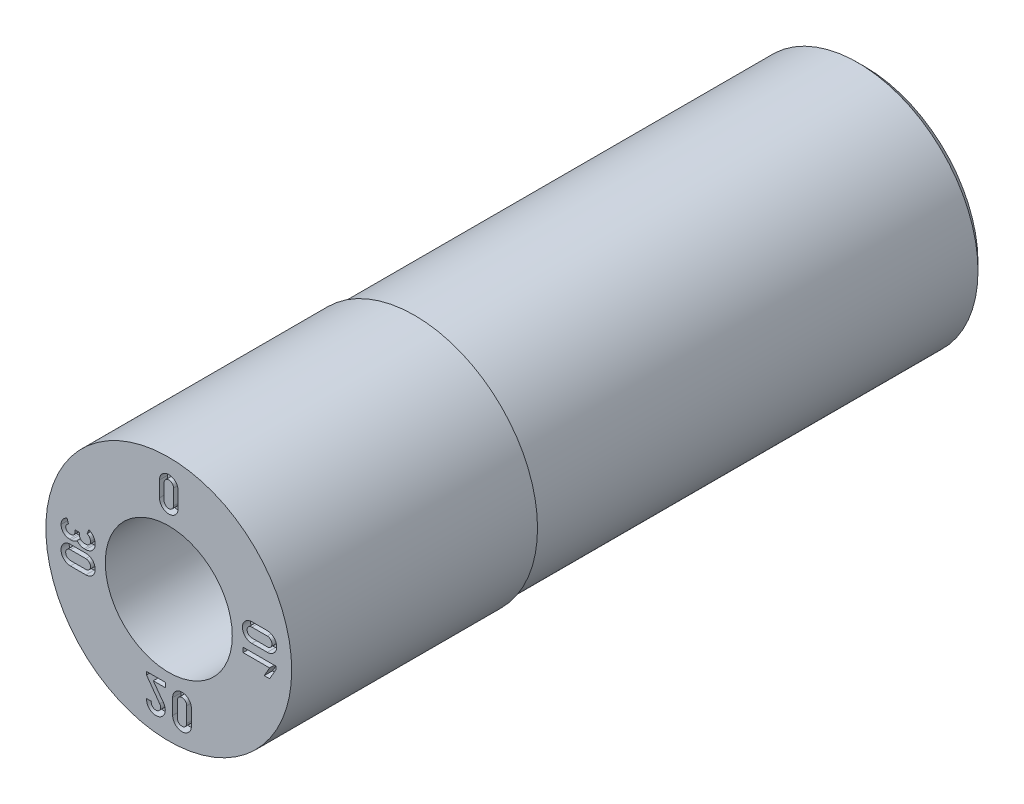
SolidWorks part; units mm, degrees
ref_plane "Front Plane" through (0, 0, 0) normal (0, 0, 1) x (1, 0, 0)
ref_plane "Top Plane" through (0, 0, 0) normal (0, 1, 0) x (1, 0, 0)
ref_plane "Right Plane" through (0, 0, 0) normal (1, 0, 0) x (0, 0, -1)
sketch "Sketch1" plane through (0, 0, 0) normal (1, 0, 0) x (0, 0, -1)
  line L2 (0, 3) -> (0, 1.55)
  line L3 (16.75, 3) -> (0, 3)
  line L4 (-3.7979, 0) -> (49996.2021, 0) construction
  line L8 (14, 0.8) -> (2.8, 0.8)
  line L9 (2.8, 1.55) -> (2.8, 0.8)
  line L10 (2.8, 1.55) -> (0, 1.55)
  line L12 (17, 1.5) -> (17, 2.75)
  line L16 (17, 2.75) -> (16.75, 3)
  line L17 (17, 1.5) -> (14, 1.5)
  line L18 (14, 0.8) -> (14, 1.5)
  dimension "D1" = 17
  dimension "D2" = 45
  dimension "D3" = 0.25
  dimension "D4" = 6
  dimension "D5" = 3.1
  dimension "D6" = 2.8
  dimension "D7" = 1.6
  dimension "D8" = 3
  dimension "D9" = 3
revolve "Revolve1" add sketch "Sketch1" angle 360 about L4
sketch "Sketch4" plane through (0, 0, 0) normal (1, 0, 0) x (0, 0, -1)
  line L0 (0, 0) -> (50000, 0) construction
  line L1 (17, -2.75) -> (17, 2.75) construction
  line L2 (6, 3.935) -> (17, 3.935)
  line L3 (6, 3.935) -> (6, 2.935)
  line L4 (6, 2.935) -> (17, 2.935)
  line L5 (17, 3.935) -> (17, 2.935)
  line L6 (16.75, 3) -> (0, 3) construction
  line L9 (0, 55) -> (0, -55) construction
  dimension "D1" = 1
  dimension "D2" = 0.065
  dimension "D3" = 6
revolve "Cut-Revolve1" cut sketch "Sketch4" angle 360 about L0
sketch "Sketch2" plane through (0, 0, 0) normal (0, 0, 1) x (1, 0, 0)
  line L522 (-2.4009, -0.0406) -> (-2.0234, -0.0406)
  line L523 (-2.0234, -0.4982) -> (-2.4009, -0.4982)
  line L524 (-2.0234, -0.3839) -> (-2.4009, -0.3838)
  line L525 (-2.4009, -0.155) -> (-2.0234, -0.155)
  line L526 (0.1154, 2.0285) -> (0.1154, 2.406)
  line L527 (-0.1134, 2.406) -> (-0.1134, 2.0285)
  line L528 (-0.2278, 2.406) -> (-0.2278, 2.0285)
  line L529 (0.2298, 2.0285) -> (0.2299, 2.406)
  line L530 (-0.0854, -1.9136) -> (-0.0854, -1.7991)
  line L531 (-0.0854, -1.7991) -> (-0.543, -1.7992)
  line L532 (-0.543, -1.7992) -> (-0.5429, -1.8748)
  line L533 (-0.5429, -1.8748) -> (-0.2212, -2.3214)
  line L534 (-0.4272, -2.3711) -> (-0.5423, -2.3711)
  line L535 (-0.1283, -2.2544) -> (-0.3771, -1.9136)
  line L536 (-0.3771, -1.9136) -> (-0.0854, -1.9136)
  line L537 (2.6155, -0.1077) -> (2.6155, -0.183)
  line L538 (2.6155, -0.183) -> (2.4614, -0.4509)
  line L539 (2.4614, -0.4509) -> (2.3295, -0.4509)
  line L540 (2.3295, -0.4509) -> (2.461, -0.2221)
  line L541 (2.461, -0.2221) -> (1.8147, -0.2222)
  line L542 (1.8147, -0.2222) -> (1.8147, -0.1078)
  line L543 (1.8147, -0.1078) -> (2.6155, -0.1077)
  line L544 (2.0271, 0.1941) -> (2.4046, 0.1942)
  line L545 (2.4046, 0.4229) -> (2.0271, 0.423)
  line L546 (2.4046, 0.5373) -> (2.0271, 0.5374)
  line L547 (2.0271, 0.0797) -> (2.4046, 0.0798)
  line L548 (-2.0231, 0.1502) -> (-2.0632, 0.1502)
  line L549 (-2.1775, 0.2646) -> (-2.1775, 0.3218)
  line L550 (-2.1775, 0.3218) -> (-2.2919, 0.3218)
  line L551 (-2.2919, 0.3218) -> (-2.2919, 0.2646)
  line L552 (-2.3834, 0.1731) -> (-2.4235, 0.1731)
  line L553 (-2.445, 0.3621) -> (-2.4816, 0.4705)
  line L554 (-2.4235, 0.0587) -> (-2.3835, 0.0587)
  line L555 (-2.0632, 0.0358) -> (-2.0231, 0.0358)
  line L556 (-1.95, 0.4934) -> (-1.992, 0.387)
  line L557 (0.5523, -2.4099) -> (0.5523, -2.0324)
  line L558 (0.0947, -2.0324) -> (0.0947, -2.4099)
  line L559 (0.2091, -2.0324) -> (0.2092, -2.4099)
  line L560 (0.4379, -2.4099) -> (0.4379, -2.0324)
  arc A244 (-2.0234, -0.4982) -> (-2.0234, -0.0406) centre (-2.0234, -0.2694) ccw
  arc A245 (-2.4009, -0.0406) -> (-2.4009, -0.4982) centre (-2.4009, -0.2694) ccw
  arc A246 (-2.0234, -0.3839) -> (-2.0234, -0.155) centre (-2.0234, -0.2694) ccw
  arc A247 (-2.4009, -0.155) -> (-2.4009, -0.3838) centre (-2.4009, -0.2694) ccw
  arc A248 (-0.1134, 2.0285) -> (0.1154, 2.0285) centre (0.001, 2.0285) ccw
  arc A249 (0.1154, 2.406) -> (-0.1134, 2.406) centre (0.001, 2.406) ccw
  arc A250 (-0.2278, 2.0285) -> (0.2298, 2.0285) centre (0.001, 2.0285) ccw
  arc A251 (0.2299, 2.406) -> (-0.2278, 2.406) centre (0.001, 2.406) ccw
  arc A252 (-0.4272, -2.3711) -> (-0.2212, -2.3214) centre (-0.3141, -2.3883) ccw
  arc A253 (-0.5423, -2.3711) -> (-0.1283, -2.2544) centre (-0.314, -2.3882) ccw
  arc A254 (2.0271, 0.423) -> (2.0271, 0.1941) centre (2.0271, 0.3086) ccw
  arc A255 (2.4046, 0.1942) -> (2.4046, 0.4229) centre (2.4046, 0.3086) ccw
  arc A256 (2.0271, 0.5374) -> (2.0271, 0.0797) centre (2.0271, 0.3086) ccw
  arc A257 (2.4046, 0.0798) -> (2.4046, 0.5373) centre (2.4046, 0.3086) ccw
  arc A258 (-1.9087, 0.2646) -> (-1.992, 0.387) centre (-2.0403, 0.2646) ccw
  arc A259 (-2.0231, 0.1502) -> (-1.9087, 0.2646) centre (-2.0231, 0.2646) ccw
  arc A260 (-2.1775, 0.2646) -> (-2.0632, 0.1502) centre (-2.0632, 0.2646) ccw
  arc A261 (-2.3834, 0.1731) -> (-2.2919, 0.2646) centre (-2.3834, 0.2646) ccw
  arc A262 (-2.515, 0.2646) -> (-2.4235, 0.1731) centre (-2.4234, 0.2647) ccw
  arc A263 (-2.445, 0.3621) -> (-2.515, 0.2646) centre (-2.4122, 0.2647) ccw
  arc A264 (-2.4816, 0.4705) -> (-2.6294, 0.2646) centre (-2.412, 0.2646) ccw
  arc A265 (-2.6294, 0.2646) -> (-2.4235, 0.0587) centre (-2.4235, 0.2646) ccw
  arc A266 (-2.3835, 0.0587) -> (-2.2388, 0.118) centre (-2.3834, 0.2645) ccw
  arc A267 (-2.2388, 0.118) -> (-2.0632, 0.0358) centre (-2.0632, 0.2645) ccw
  arc A268 (-2.0231, 0.0358) -> (-1.7943, 0.2646) centre (-2.0231, 0.2645) ccw
  arc A269 (-1.7943, 0.2646) -> (-1.95, 0.4934) centre (-2.0404, 0.2645) ccw
  arc A270 (0.5523, -2.0324) -> (0.0947, -2.0324) centre (0.3235, -2.0324) ccw
  arc A271 (0.0947, -2.4099) -> (0.5523, -2.4099) centre (0.3235, -2.4099) ccw
  arc A272 (0.4379, -2.0324) -> (0.2091, -2.0324) centre (0.3235, -2.0324) ccw
  arc A273 (0.2092, -2.4099) -> (0.4379, -2.4099) centre (0.3235, -2.4099) ccw
  point P1009 (0, 0.0046)
  point P1010 (0.0046, 0.0046)
  point P1011 (0.0046, 0)
extrude "Cut-Extrude1" cut sketch "Sketch2" against normal blind 0.2
sketch "Sketch3" plane through (0, 0, -2.8) normal (0, 0, 1) x (1, 0, 0)
  line L0 (0, 0) -> (0, 50000) construction
  line L1 (0.4619, 0.8) -> (-0.4619, 0.8)
  line L2 (-0.4619, 0.8) -> (-0.9238, 0)
  line L3 (-0.9238, 0) -> (-0.4619, -0.8)
  line L4 (-0.4619, -0.8) -> (0.4619, -0.8)
  line L5 (0.4619, -0.8) -> (0.9238, 0)
  line L6 (0.9238, 0) -> (0.4619, 0.8)
  line L7 (0, 0) -> (50000, 0) construction
  circle A0 centre (0, 0) radius 0.8 construction
  circle A1 centre (0, 0) radius 0.8 construction
extrude "Cut-Extrude2" cut sketch "Sketch3" against normal blind 1.4
